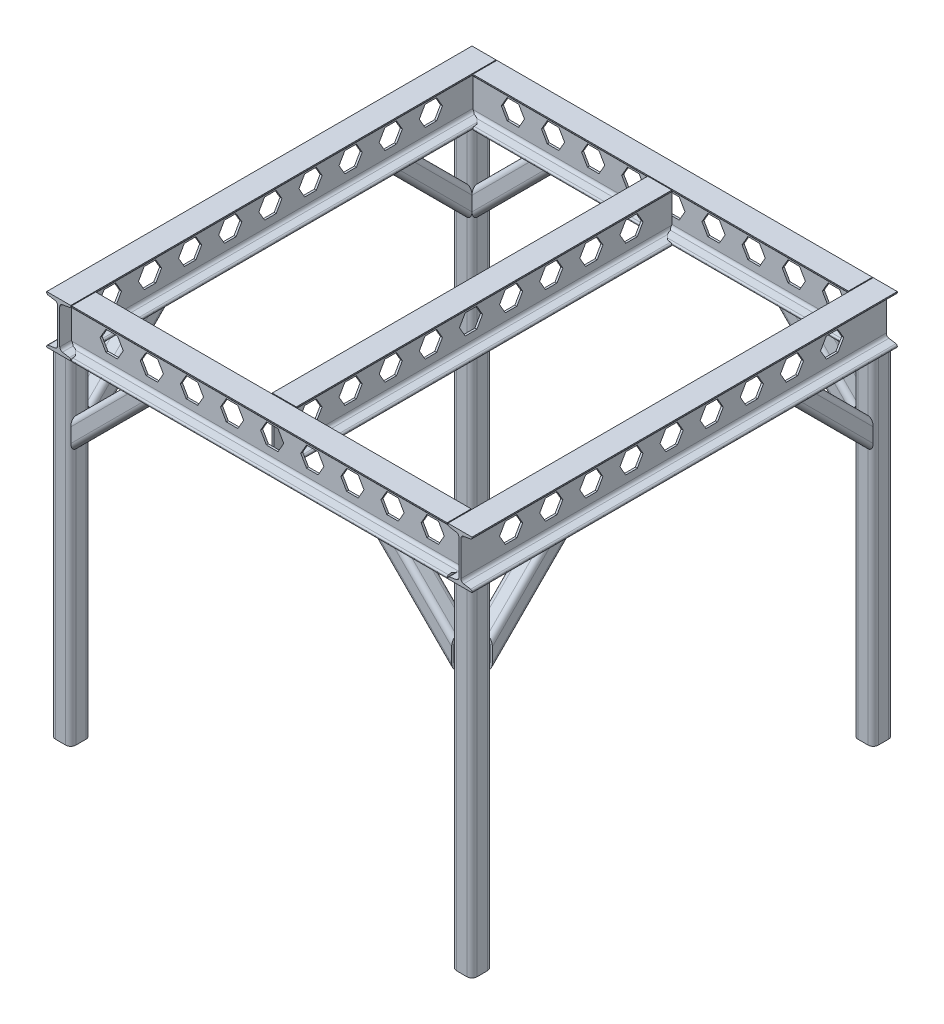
SolidWorks part; units mm, degrees
other "DetailItem2"
other "DetailItem3"
other "DetailItem4"
other "DetailItem5"
other "Weld Folder"
other "Weld Bead2"
other "Weld Bead3"
other "Weld Bead4"
other "Weld Bead5"
ref_plane "Front Plane" through (0, 0, 0) normal (0, 0, 1) x (1, 0, 0)
ref_plane "Top Plane" through (0, 0, 0) normal (0, 1, 0) x (1, 0, 0)
ref_plane "Right Plane" through (0, 0, 0) normal (1, 0, 0) x (0, 0, -1)
sketch3d "3DSketch4"
  line L0 (0, 0, 0) -> (0, 0, -1000)
  line L1 (0, 0, -1000) -> (-1000, 0, -1000)
  line L2 (-1000, 0, -1000) -> (-1000, 0, 0)
  line L3 (-1000, 0, 0) -> (0, 0, 0)
  line L4 (0, 0, 0) -> (0, -900, 0)
  line L5 (0, 0, -1000) -> (0, -900, -1000)
  line L6 (-1000, 0, -1000) -> (-1000, -900, -1000)
  line L7 (-1000, 0, 0) -> (-1000, -900, 0)
  line L8 (-500, 0, 0) -> (-500, 0, -1000)
  line L9 (0, -250, 0) -> (0, 0, -250)
  line L10 (0, -250, 0) -> (-250, 0, 0)
  line L11 (0, 0, -750) -> (0, -250, -1000)
  line L12 (0, -250, -1000) -> (-250, 0, -1000)
  line L13 (-750, 0, 0) -> (-1000, -250, 0)
  line L14 (-1000, -250, 0) -> (-1000, 0, -250)
  line L15 (-1000, 0, -750) -> (-1000, -250, -1000)
  line L16 (-1000, -250, -1000) -> (-750, 0, -1000)
  dimension "D1" = 900
  dimension "D2" = 1000
  dimension "D3" = 250
  dimension "D4" = 45
  dimension "D5" = 250
  dimension "D6" = 250
  dimension "D7" = 250
other "Structural Member1"
ref_plane "Plane2" through (-1000, 0, 0) normal (1, 0, 0) x (0, 0, -1)
sketch "Sketch113" plane through (-1000, 0, 0) normal (1, 0, 0) x (0, 0, -1)
  line L0 (-30, -60) -> (-30, -58.0801)
  line L1 (-26.6576, -54.1345) -> (-9.1847, -51.2221)
  line L2 (-2.5, -43.331) -> (-2.5, 43.331)
  line L3 (-9.1847, 51.2221) -> (-26.6576, 54.1345)
  line L4 (-30, 58.0801) -> (-30, 60)
  line L5 (-30, 60) -> (30, 60)
  line L6 (30, 60) -> (30, 58.0801)
  line L7 (26.6576, 54.1345) -> (9.1847, 51.2221)
  line L8 (2.5, 43.331) -> (2.5, -43.331)
  line L9 (9.1847, -51.2221) -> (26.6576, -54.1345)
  line L10 (30, -58.0801) -> (30, -60)
  line L11 (30, -60) -> (-30, -60)
  line L15 (-2.5, 0) -> (2.5, 0) construction
  arc A0 (-9.1847, -51.2221) -> (-2.5, -43.331) centre (-10.5, -43.331) ccw
  arc A1 (-2.5, 43.331) -> (-9.1847, 51.2221) centre (-10.5, 43.331) ccw
  arc A2 (9.1847, 51.2221) -> (2.5, 43.331) centre (10.5, 43.331) ccw
  arc A3 (2.5, -43.331) -> (9.1847, -51.2221) centre (10.5, -43.331) ccw
  arc A4 (-26.6576, 54.1345) -> (-30, 58.0801) centre (-26, 58.0801) cw
  arc A5 (26.6576, 54.1345) -> (30, 58.0801) centre (26, 58.0801) ccw
  arc A6 (-30, -58.0801) -> (-26.6576, -54.1345) centre (-26, -58.0801) cw
  arc A7 (30, -58.0801) -> (26.6576, -54.1345) centre (26, -58.0801) ccw
  point P1 (0, 60)
  point P8 (0, -60)
  point P21 (0, 0)
  point P34 (0, 0)
  dimension "RI" = 8
  dimension "D3" = 4
  dimension "BF" = 60
  dimension "D2" = 9.463
  dimension "DEPTH" = 120
  dimension "TW" = 5
  dimension "D1" = 86.662
other "Structural Member2"
ref_plane "Plane3" through (-1000, 0, 0) normal (0, -1, 0) x (1, 0, 0)
sketch "Sketch111" plane through (-1000, 0, 0) normal (0, -1, 0) x (1, 0, 0)
  line L0 (-12.7, -19.05) -> (12.7, -19.05)
  line L1 (-19.05, -12.7) -> (-19.05, 12.7)
  line L2 (12.7, 19.05) -> (-12.7, 19.05)
  line L3 (19.05, 12.7) -> (19.05, -12.7)
  line L4 (-12.7, -25.4) -> (12.7, -25.4)
  line L5 (-25.4, -12.7) -> (-25.4, 12.7)
  line L6 (12.7, 25.4) -> (-12.7, 25.4)
  line L7 (25.4, 12.7) -> (25.4, -12.7)
  line L8 (0, 0) -> (19.05, 0) construction
  line L9 (0, 0) -> (0, 19.05) construction
  arc A0 (25.4, 12.7) -> (12.7, 25.4) centre (12.7, 12.7) ccw
  arc A1 (12.7, -25.4) -> (25.4, -12.7) centre (12.7, -12.7) ccw
  arc A2 (-25.4, -12.7) -> (-12.7, -25.4) centre (-12.7, -12.7) ccw
  arc A3 (-12.7, 25.4) -> (-25.4, 12.7) centre (-12.7, 12.7) ccw
  arc A4 (-12.7, 19.05) -> (-19.05, 12.7) centre (-12.7, 12.7) ccw
  arc A5 (19.05, 12.7) -> (12.7, 19.05) centre (12.7, 12.7) ccw
  arc A6 (12.7, -19.05) -> (19.05, -12.7) centre (12.7, -12.7) ccw
  arc A7 (-19.05, -12.7) -> (-12.7, -19.05) centre (-12.7, -12.7) ccw
  point P3 (0, 25.4)
  point P4 (25.4, 0)
  point P5 (0, -25.4)
  point P6 (-25.4, 0)
  point P7 (-25.4, 25.4)
  point P8 (-25.4, -25.4)
  point P33 (0, 0)
  point P35 (25.4, -25.4)
  point P36 (25.4, 25.4)
  point P37 (0, 0)
  dimension "D1" = 12.7
  dimension "Thickness" = 6.35
  dimension "V_leg" = 50.8
other "Trim/Extend1"
other "Structural Member3"
ref_plane "Plane4" through (0, -250, 0) normal (0, 0.7071, -0.7071) x (1, 0, 0)
sketch "Sketch114" plane through (0, -250, 0) normal (0, 0.7071, -0.7071) x (1, 0, 0)
  line L0 (-12.7, -19.05) -> (12.7, -19.05)
  line L1 (-19.05, -12.7) -> (-19.05, 12.7)
  line L2 (12.7, 19.05) -> (-12.7, 19.05)
  line L3 (19.05, 12.7) -> (19.05, -12.7)
  line L4 (-12.7, -25.4) -> (12.7, -25.4)
  line L5 (-25.4, -12.7) -> (-25.4, 12.7)
  line L6 (12.7, 25.4) -> (-12.7, 25.4)
  line L7 (25.4, 12.7) -> (25.4, -12.7)
  line L8 (0, 0) -> (19.05, 0) construction
  line L9 (0, 0) -> (0, 19.05) construction
  arc A0 (25.4, 12.7) -> (12.7, 25.4) centre (12.7, 12.7) ccw
  arc A1 (12.7, -25.4) -> (25.4, -12.7) centre (12.7, -12.7) ccw
  arc A2 (-25.4, -12.7) -> (-12.7, -25.4) centre (-12.7, -12.7) ccw
  arc A3 (-12.7, 25.4) -> (-25.4, 12.7) centre (-12.7, 12.7) ccw
  arc A4 (-12.7, 19.05) -> (-19.05, 12.7) centre (-12.7, 12.7) ccw
  arc A5 (19.05, 12.7) -> (12.7, 19.05) centre (12.7, 12.7) ccw
  arc A6 (12.7, -19.05) -> (19.05, -12.7) centre (12.7, -12.7) ccw
  arc A7 (-19.05, -12.7) -> (-12.7, -19.05) centre (-12.7, -12.7) ccw
  point P3 (0, 25.4)
  point P4 (25.4, 0)
  point P5 (0, -25.4)
  point P6 (-25.4, 0)
  point P7 (-25.4, 25.4)
  point P8 (-25.4, -25.4)
  point P33 (0, 0)
  point P35 (25.4, -25.4)
  point P36 (25.4, 25.4)
  point P37 (0, 0)
  dimension "D1" = 12.7
  dimension "Thickness" = 6.35
  dimension "V_leg" = 50.8
other "Trim/Extend2"
other "Structural Member4"
ref_plane "Plane5" through (-750, 0, 0) normal (-0.7071, -0.7071, 0) x (0, 0, 1)
sketch "Sketch116" plane through (-750, 0, 0) normal (-0.7071, -0.7071, 0) x (0, 0, 1)
  line L0 (-12.7, -19.05) -> (12.7, -19.05)
  line L1 (-19.05, -12.7) -> (-19.05, 12.7)
  line L2 (12.7, 19.05) -> (-12.7, 19.05)
  line L3 (19.05, 12.7) -> (19.05, -12.7)
  line L4 (-12.7, -25.4) -> (12.7, -25.4)
  line L5 (-25.4, -12.7) -> (-25.4, 12.7)
  line L6 (12.7, 25.4) -> (-12.7, 25.4)
  line L7 (25.4, 12.7) -> (25.4, -12.7)
  line L8 (0, 0) -> (19.05, 0) construction
  line L9 (0, 0) -> (0, 19.05) construction
  arc A0 (25.4, 12.7) -> (12.7, 25.4) centre (12.7, 12.7) ccw
  arc A1 (12.7, -25.4) -> (25.4, -12.7) centre (12.7, -12.7) ccw
  arc A2 (-25.4, -12.7) -> (-12.7, -25.4) centre (-12.7, -12.7) ccw
  arc A3 (-12.7, 25.4) -> (-25.4, 12.7) centre (-12.7, 12.7) ccw
  arc A4 (-12.7, 19.05) -> (-19.05, 12.7) centre (-12.7, 12.7) ccw
  arc A5 (19.05, 12.7) -> (12.7, 19.05) centre (12.7, 12.7) ccw
  arc A6 (12.7, -19.05) -> (19.05, -12.7) centre (12.7, -12.7) ccw
  arc A7 (-19.05, -12.7) -> (-12.7, -19.05) centre (-12.7, -12.7) ccw
  point P3 (0, 25.4)
  point P4 (25.4, 0)
  point P5 (0, -25.4)
  point P6 (-25.4, 0)
  point P7 (-25.4, 25.4)
  point P8 (-25.4, -25.4)
  point P33 (0, 0)
  point P35 (25.4, -25.4)
  point P36 (25.4, 25.4)
  point P37 (0, 0)
  dimension "D1" = 12.7
  dimension "Thickness" = 6.35
  dimension "V_leg" = 50.8
other "Trim/Extend3"
other "Structural Member7"
ref_plane "Plane8" through (-500, 0, 0) normal (0, 0, -1) x (1, 0, 0)
sketch "Sketch117" plane through (-500, 0, 0) normal (0, 0, -1) x (1, 0, 0)
  line L0 (-30, -60) -> (-30, -58.0801)
  line L1 (-26.6576, -54.1345) -> (-9.1847, -51.2221)
  line L2 (-2.5, -43.331) -> (-2.5, 43.331)
  line L3 (-9.1847, 51.2221) -> (-26.6576, 54.1345)
  line L4 (-30, 58.0801) -> (-30, 60)
  line L5 (-30, 60) -> (30, 60)
  line L6 (30, 60) -> (30, 58.0801)
  line L7 (26.6576, 54.1345) -> (9.1847, 51.2221)
  line L8 (2.5, 43.331) -> (2.5, -43.331)
  line L9 (9.1847, -51.2221) -> (26.6576, -54.1345)
  line L10 (30, -58.0801) -> (30, -60)
  line L11 (30, -60) -> (-30, -60)
  line L15 (-2.5, 0) -> (2.5, 0) construction
  arc A0 (-9.1847, -51.2221) -> (-2.5, -43.331) centre (-10.5, -43.331) ccw
  arc A1 (-2.5, 43.331) -> (-9.1847, 51.2221) centre (-10.5, 43.331) ccw
  arc A2 (9.1847, 51.2221) -> (2.5, 43.331) centre (10.5, 43.331) ccw
  arc A3 (2.5, -43.331) -> (9.1847, -51.2221) centre (10.5, -43.331) ccw
  arc A4 (-26.6576, 54.1345) -> (-30, 58.0801) centre (-26, 58.0801) cw
  arc A5 (26.6576, 54.1345) -> (30, 58.0801) centre (26, 58.0801) ccw
  arc A6 (-30, -58.0801) -> (-26.6576, -54.1345) centre (-26, -58.0801) cw
  arc A7 (30, -58.0801) -> (26.6576, -54.1345) centre (26, -58.0801) ccw
  point P1 (0, 60)
  point P8 (0, -60)
  point P21 (0, 0)
  point P34 (0, 0)
  dimension "RI" = 8
  dimension "D3" = 4
  dimension "BF" = 60
  dimension "D2" = 9.463
  dimension "DEPTH" = 120
  dimension "TW" = 5
  dimension "D1" = 86.662
other "Trim/Extend6"
ref_plane "Plane9" through (0, 0, -500) normal (0, 0, 1) x (1, 0, 0)
mirror "Mirror1" about plane through (0, 0, -500) normal (0, 0, 1)
sketch "Sketch18" plane through (2.5, 0, 0) normal (1, 0, 0) x (0, 0, -1)
  line L0 (-30, 0) -> (1030, 0) construction
  line L1 (-30, -43.331) -> (-30, 43.331) construction
  line L2 (1030, 43.331) -> (1030, -43.331) construction
  line L3 (180.5662, -25) -> (209.4338, -25)
  line L4 (123.8675, 0) -> (109.4338, 25)
  line L5 (109.4338, 25) -> (80.5662, 25)
  line L6 (80.5662, 25) -> (66.1325, 0)
  line L7 (66.1325, 0) -> (80.5662, -25)
  line L8 (80.5662, -25) -> (109.4338, -25)
  line L9 (109.4338, -25) -> (123.8675, 0)
  line L10 (166.1325, 0) -> (180.5662, -25)
  line L11 (180.5662, 25) -> (166.1325, 0)
  line L12 (209.4338, 25) -> (180.5662, 25)
  line L13 (223.8675, 0) -> (209.4338, 25)
  line L14 (209.4338, -25) -> (223.8675, 0)
  line L15 (280.5662, -25) -> (309.4338, -25)
  line L16 (266.1325, 0) -> (280.5662, -25)
  line L17 (280.5662, 25) -> (266.1325, 0)
  line L18 (309.4338, 25) -> (280.5662, 25)
  line L19 (323.8675, 0) -> (309.4338, 25)
  line L20 (309.4338, -25) -> (323.8675, 0)
  line L21 (380.5662, -25) -> (409.4338, -25)
  line L22 (366.1325, 0) -> (380.5662, -25)
  line L23 (380.5662, 25) -> (366.1325, 0)
  line L24 (409.4338, 25) -> (380.5662, 25)
  line L25 (423.8675, 0) -> (409.4338, 25)
  line L26 (409.4338, -25) -> (423.8675, 0)
  line L27 (480.5662, -25) -> (509.4338, -25)
  line L28 (466.1325, 0) -> (480.5662, -25)
  line L29 (480.5662, 25) -> (466.1325, 0)
  line L30 (509.4338, 25) -> (480.5662, 25)
  line L31 (523.8675, 0) -> (509.4338, 25)
  line L32 (509.4338, -25) -> (523.8675, 0)
  line L33 (580.5662, -25) -> (609.4338, -25)
  line L34 (566.1325, 0) -> (580.5662, -25)
  line L35 (580.5662, 25) -> (566.1325, 0)
  line L36 (609.4338, 25) -> (580.5662, 25)
  line L37 (623.8675, 0) -> (609.4338, 25)
  line L38 (609.4338, -25) -> (623.8675, 0)
  line L39 (680.5662, -25) -> (709.4338, -25)
  line L40 (666.1325, 0) -> (680.5662, -25)
  line L41 (680.5662, 25) -> (666.1325, 0)
  line L42 (709.4338, 25) -> (680.5662, 25)
  line L43 (723.8675, 0) -> (709.4338, 25)
  line L44 (709.4338, -25) -> (723.8675, 0)
  line L45 (780.5662, -25) -> (809.4338, -25)
  line L46 (766.1325, 0) -> (780.5662, -25)
  line L47 (780.5662, 25) -> (766.1325, 0)
  line L48 (809.4338, 25) -> (780.5662, 25)
  line L49 (823.8675, 0) -> (809.4338, 25)
  line L50 (809.4338, -25) -> (823.8675, 0)
  line L51 (880.5662, -25) -> (909.4338, -25)
  line L52 (866.1325, 0) -> (880.5662, -25)
  line L53 (880.5662, 25) -> (866.1325, 0)
  line L54 (909.4338, 25) -> (880.5662, 25)
  line L55 (923.8675, 0) -> (909.4338, 25)
  line L56 (909.4338, -25) -> (923.8675, 0)
  circle A0 centre (95, 0) radius 25 construction
  dimension "D1" = 125
  dimension "D2" = 9
extrude "Cut-Extrude1" cut sketch "Sketch18" against normal through all
sketch "Sketch19" plane through (0, 0, 2.5) normal (0, 0, 1) x (1, 0, 0)
  line L0 (-997.5, 0) -> (0, 0) construction
  line L1 (-995.5, -42.5977) -> (-995.5, 42.5977) construction
  line L2 (-866.6325, 0) -> (-881.0662, 25)
  line L3 (-881.0662, 25) -> (-909.9338, 25)
  line L4 (-909.9338, 25) -> (-924.3675, 0)
  line L5 (-924.3675, 0) -> (-909.9338, -25)
  line L6 (-909.9338, -25) -> (-881.0662, -25)
  line L7 (-881.0662, -25) -> (-866.6325, 0)
  line L8 (-809.9338, -25) -> (-781.0662, -25)
  line L9 (-824.3675, 0) -> (-809.9338, -25)
  line L10 (-809.9338, 25) -> (-824.3675, 0)
  line L11 (-781.0662, 25) -> (-809.9338, 25)
  line L12 (-766.6325, 0) -> (-781.0662, 25)
  line L13 (-781.0662, -25) -> (-766.6325, 0)
  line L14 (-709.9338, -25) -> (-681.0662, -25)
  line L15 (-724.3675, 0) -> (-709.9338, -25)
  line L16 (-709.9338, 25) -> (-724.3675, 0)
  line L17 (-681.0662, 25) -> (-709.9338, 25)
  line L18 (-666.6325, 0) -> (-681.0662, 25)
  line L19 (-681.0662, -25) -> (-666.6325, 0)
  line L20 (-609.9338, -25) -> (-581.0662, -25)
  line L21 (-624.3675, 0) -> (-609.9338, -25)
  line L22 (-609.9338, 25) -> (-624.3675, 0)
  line L23 (-581.0662, 25) -> (-609.9338, 25)
  line L24 (-566.6325, 0) -> (-581.0662, 25)
  line L25 (-581.0662, -25) -> (-566.6325, 0)
  line L26 (-509.9338, -25) -> (-481.0662, -25)
  line L27 (-524.3675, 0) -> (-509.9338, -25)
  line L28 (-509.9338, 25) -> (-524.3675, 0)
  line L29 (-481.0662, 25) -> (-509.9338, 25)
  line L30 (-466.6325, 0) -> (-481.0662, 25)
  line L31 (-481.0662, -25) -> (-466.6325, 0)
  line L32 (-409.9338, -25) -> (-381.0662, -25)
  line L33 (-424.3675, 0) -> (-409.9338, -25)
  line L34 (-409.9338, 25) -> (-424.3675, 0)
  line L35 (-381.0662, 25) -> (-409.9338, 25)
  line L36 (-366.6325, 0) -> (-381.0662, 25)
  line L37 (-381.0662, -25) -> (-366.6325, 0)
  line L38 (-309.9338, -25) -> (-281.0662, -25)
  line L39 (-324.3675, 0) -> (-309.9338, -25)
  line L40 (-309.9338, 25) -> (-324.3675, 0)
  line L41 (-281.0662, 25) -> (-309.9338, 25)
  line L42 (-266.6325, 0) -> (-281.0662, 25)
  line L43 (-281.0662, -25) -> (-266.6325, 0)
  line L44 (-209.9338, -25) -> (-181.0662, -25)
  line L45 (-224.3675, 0) -> (-209.9338, -25)
  line L46 (-209.9338, 25) -> (-224.3675, 0)
  line L47 (-181.0662, 25) -> (-209.9338, 25)
  line L48 (-166.6325, 0) -> (-181.0662, 25)
  line L49 (-181.0662, -25) -> (-166.6325, 0)
  line L50 (-109.9338, -25) -> (-81.0662, -25)
  line L51 (-124.3675, 0) -> (-109.9338, -25)
  line L52 (-109.9338, 25) -> (-124.3675, 0)
  line L53 (-81.0662, 25) -> (-109.9338, 25)
  line L54 (-66.6325, 0) -> (-81.0662, 25)
  line L55 (-81.0662, -25) -> (-66.6325, 0)
  circle A0 centre (-895.5, 0) radius 25 construction
  dimension "D1" = 100
  dimension "D2" = 9
extrude "Cut-Extrude2" cut sketch "Sketch19" against normal through all
